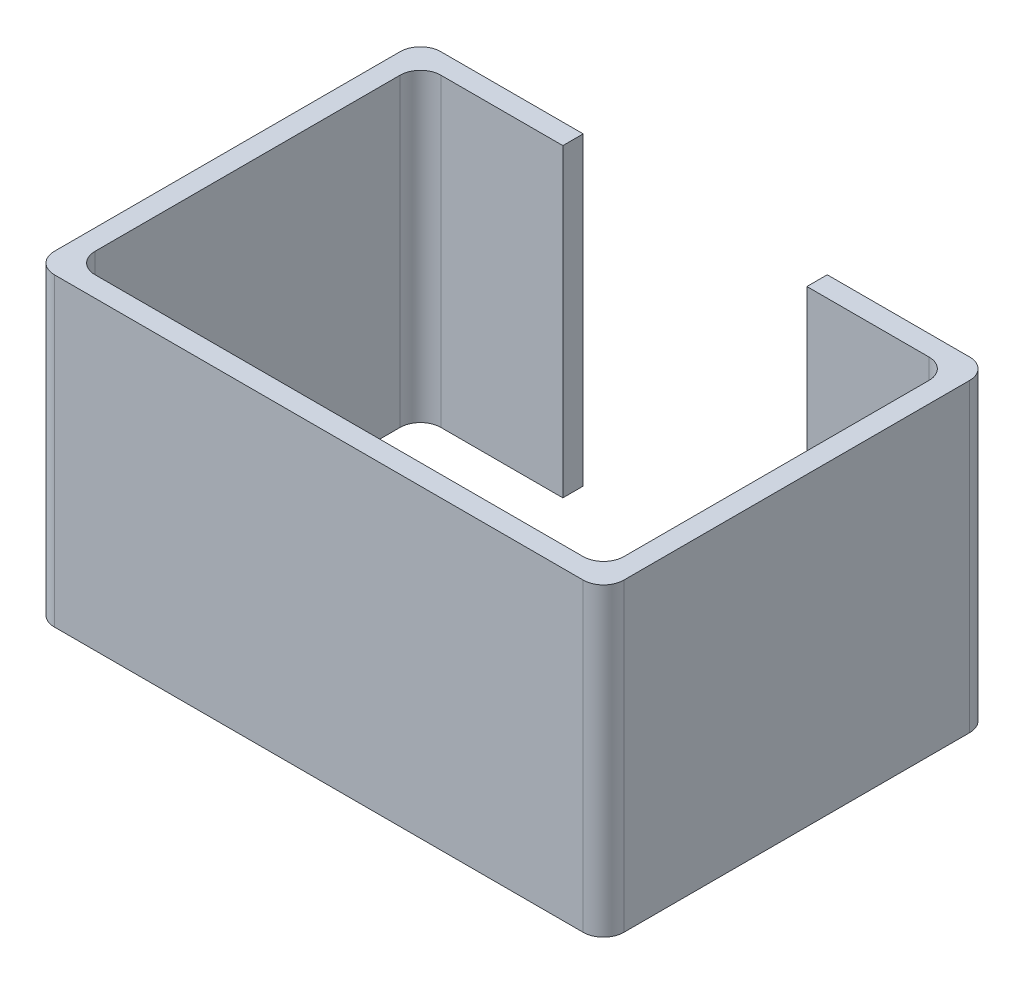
SolidWorks part; units mm, degrees
ref_plane "Front" through (0, 0, 0) normal (0, 0, 1) x (1, 0, 0)
ref_plane "Top" through (0, 0, 0) normal (0, 1, 0) x (1, 0, 0)
ref_plane "Right" through (0, 0, 0) normal (1, 0, 0) x (0, 0, -1)
sketch "Sketch1" plane through (0, 0, 0) normal (0, 1, 0) x (1, 0, 0)
  line L0 (0, 0) -> (-8, 0)
  line L1 (-8, 0) -> (-8, -19)
  line L2 (-8, -19) -> (20, -19)
  line L3 (20, -19) -> (20, 0)
  line L4 (0, -1) -> (-7, -1)
  line L5 (20, 0) -> (12, 0)
  line L6 (-7, -1) -> (-7, -18)
  line L7 (-7, -18) -> (19, -18)
  line L8 (19, -18) -> (19, -1)
  line L9 (19, -1) -> (12, -1)
  line L10 (0, 0) -> (0, -1)
  line L11 (12, 0) -> (12, -1)
extrude "Extrude1" add sketch "Sketch1" along normal blind 15
fillet "Fillet1" radius 1 1 edges at (20, 7.5, 19)
fillet "Fillet2" radius 1 1 edges at (-8, 7.5, 19)
fillet "Fillet4" radius 1 1 edges at (20, 7.5, 0)
fillet "Fillet5" radius 1 1 edges at (-7, 7.5, 18)
fillet "Fillet6" radius 1 1 edges at (19, 7.5, 18)
fillet "Fillet7" radius 1 1 edges at (-8, 7.5, 0)
fillet "Fillet8" radius 1 1 edges at (19, 7.5, 1)
fillet "Fillet9" radius 1 1 edges at (-7, 7.5, 1)
